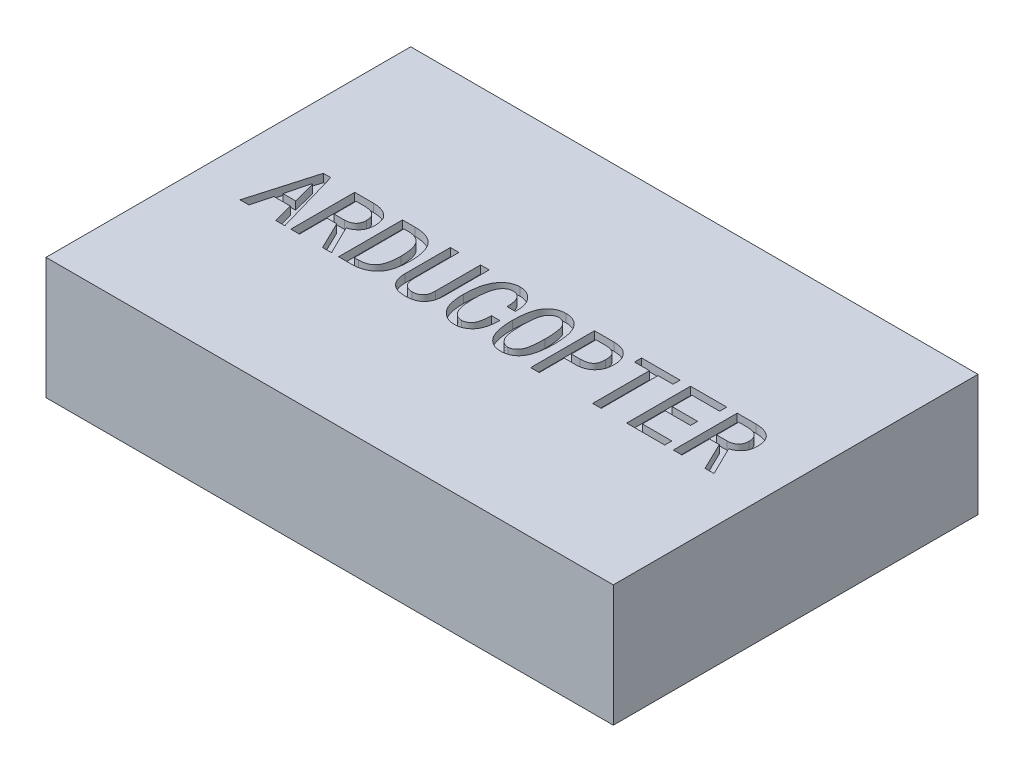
SolidWorks part; units mm, degrees
ref_plane "前视基准面" through (0, 0, 0) normal (0, 0, 1) x (1, 0, 0)
ref_plane "上视基准面" through (0, 0, 0) normal (0, 1, 0) x (1, 0, 0)
ref_plane "右视基准面" through (0, 0, 0) normal (1, 0, 0) x (0, 0, -1)
other "Configuration Table"
sketch "草图1" plane through (0, 0, 0) normal (0, 1, 0) x (1, 0, 0)
  line L1 (-35, 22.5) -> (35, 22.5)
  line L2 (-35, 22.5) -> (-35, -22.5)
  line L3 (-35, -22.5) -> (35, -22.5)
  line L4 (35, 22.5) -> (35, -22.5)
  line L5 (0, -22.5) -> (0, 22.5) construction
  line L6 (-35, 0) -> (35, 0) construction
  point P0 (0, 0)
  dimension "D1" = 70
  dimension "D2" = 45
extrude "凸台-拉伸1" add sketch "草图1" along normal blind 15 contours L2 L3 L4 L1
sketch "草图2" plane through (0, 15, 0) normal (0, 1, 0) x (1, 0, 0)
  text T0 "ARDUCOPTER" font "楷体" height in points 26
extrude "切除-拉伸1" cut sketch "草图2" against normal blind 1
